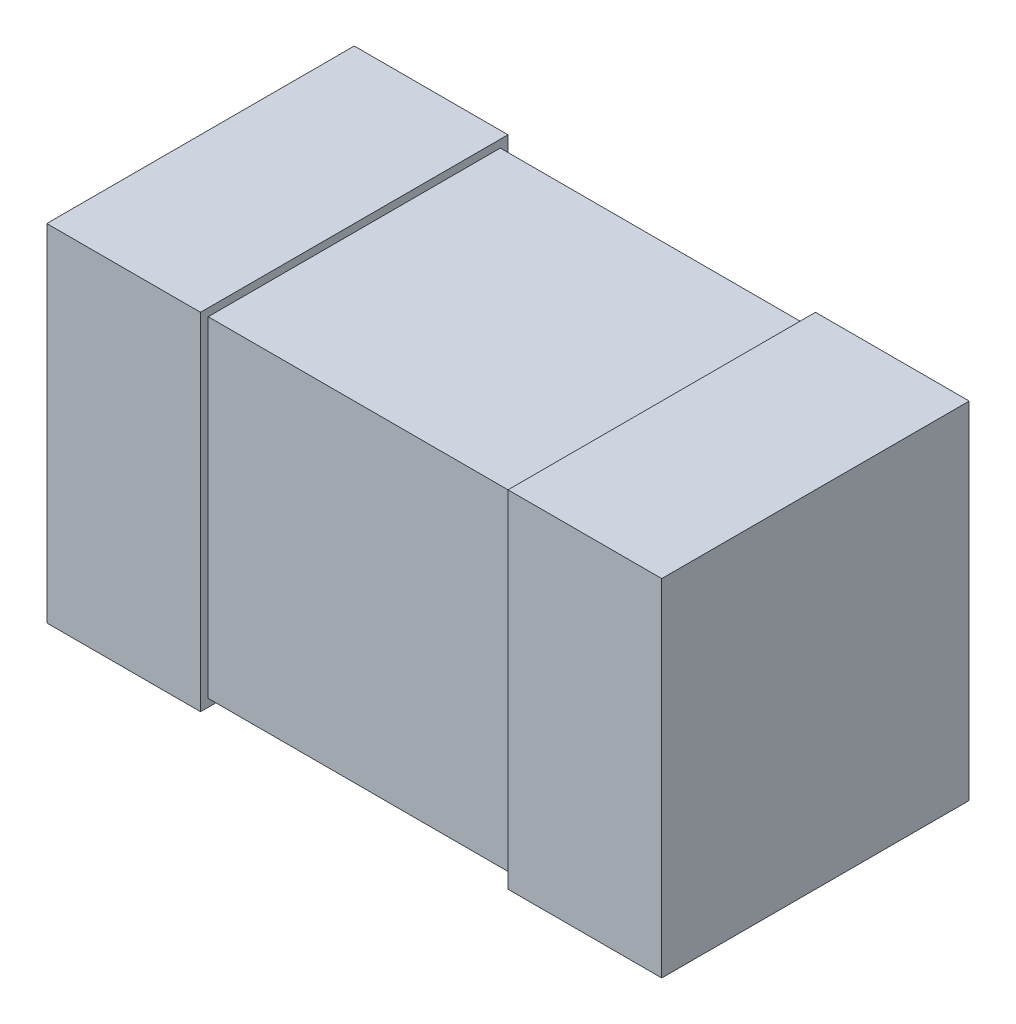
SolidWorks part; units mm, degrees
ref_plane "Front" through (0, 0, 0) normal (0, 0, 1) x (1, 0, 0)
ref_plane "Top" through (0, 0, 0) normal (0, 1, 0) x (1, 0, 0)
ref_plane "Right" through (0, 0, 0) normal (1, 0, 0) x (0, 0, -1)
sketch "Эскиз1" plane through (0, 0, 0) normal (0, 1, 0) x (1, 0, 0)
  line L0 (0, -0.4) -> (0, 0.4) construction
  line L1 (-0.8, -0.4) -> (-0.4, -0.4)
  line L2 (-0.8, -0.4) -> (-0.8, 0.4)
  line L3 (-0.8, 0.4) -> (-0.4, 0.4)
  line L4 (-0.4, -0.4) -> (-0.4, 0.4)
  line L5 (0.4, -0.4) -> (0.4, 0.4)
  line L6 (0.8, 0.4) -> (0.4, 0.4)
  line L7 (0.8, -0.4) -> (0.8, 0.4)
  line L8 (0.8, -0.4) -> (0.4, -0.4)
  dimension "W" = 0.8
  dimension "L" = 1.6
  dimension "L2" = 0.4
extrude "Вытянуть1" add sketch "Эскиз1" along normal blind 0.9
sketch "Эскиз2" plane through (-0.4, 0, 0) normal (1, 0, 0) x (0, 0, -1)
  line L0 (-0.38, 0.02) -> (0.38, 0.02)
  line L1 (0.38, 0.02) -> (0.38, 0.88)
  line L2 (0.38, 0.88) -> (-0.38, 0.88)
  line L3 (-0.38, 0.88) -> (-0.38, 0.02)
  line L4 (-0.4, 0) -> (0.4, 0)
  line L5 (0.4, 0) -> (0.4, 0.9)
  line L6 (0.4, 0.9) -> (-0.4, 0.9)
  line L7 (-0.4, 0.9) -> (-0.4, 0)
  line L8 (-0.4, 0) -> (0.4, 0) construction
  line L9 (0.4, 0) -> (0.4, 0.9) construction
  line L10 (0.4, 0.9) -> (-0.4, 0.9) construction
  line L11 (-0.4, 0.9) -> (-0.4, 0) construction
  dimension "D1" = 0
  dimension "D2" = 0.02
extrude "Вытянуть2" add sketch "Эскиз2" along normal up to surface (0.8 mm away)
